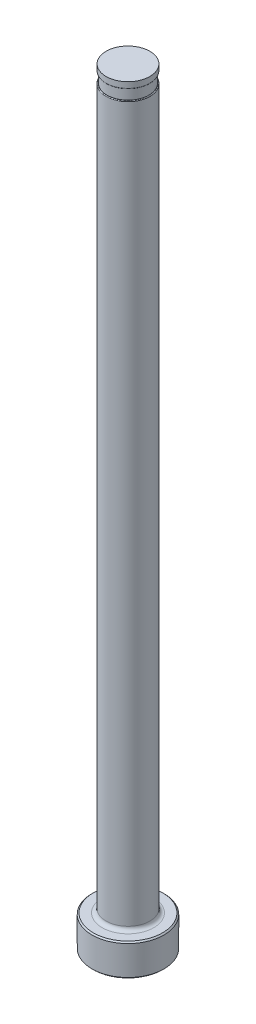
SolidWorks part; units mm, degrees
ref_plane "Front Plane" through (0, 0, 0) normal (0, 0, 1) x (1, 0, 0)
ref_plane "Top Plane" through (0, 0, 0) normal (0, 1, 0) x (1, 0, 0)
ref_plane "Right Plane" through (0, 0, 0) normal (1, 0, 0) x (0, 0, -1)
other "Configuration Table"
sketch "Sketch1" plane through (0, 0, 0) normal (0, 0, 1) x (1, 0, 0)
  line L0 (0, 259.9588) -> (0, -15.1925) construction
  line L1 (0, 0) -> (-7.1374, 0)
  line L2 (-7.1374, 0) -> (-7.1374, 6.35)
  line L3 (-7.1374, 6.35) -> (-4.365, 6.35)
  line L4 (-4.365, 6.35) -> (-4.365, 152.4)
  line L5 (-4.365, 152.4) -> (0, 152.4)
  line L6 (0, 152.4) -> (0, 0)
  dimension "L" = 152.4
  dimension "H" = 14.2748
  dimension "T" = 6.35
  dimension "D" = 8.73
revolve "Revolve1" add sketch "Sketch1" angle 360 about L0
chamfer "Chamfer1" distance 0.254 angle 45 2 edges at (0, 6.35, 7.1374) (0, 0, 7.1374)
fillet "Fillet1" radius 0.762 1 edges at (0, 6.35, 4.365)
sketch "Sketch2" plane through (0, 0, 0) normal (0, 0, 1) x (1, 0, 0)
  line L0 (-4.365, 152.4) -> (-4.365, 7.112) construction
  line L1 (-4.365, 151.13) -> (-4.1618, 151.13)
  line L2 (-4.365, 151.13) -> (-4.365, 149.098)
  line L3 (-4.365, 149.098) -> (-4.1618, 149.098)
  line L4 (-4.1618, 151.13) -> (-4.1618, 149.098)
  line L5 (4.365, 152.4) -> (-4.365, 152.4) construction
  line L6 (0, 153.4483) -> (0, 147.3282) construction
  dimension "D1" = 2.032
  dimension "N" = 1.27
  dimension "FD" = 0.2032
  dimension "D3" = 8.3236
revolve "Vent Relief" cut sketch "Sketch2" angle 360 about L6
sketch "Sketch3" plane through (0, 0, 0) normal (0, 0, 1) x (1, 0, 0)
  line L0 (-4.1618, 150.114) -> (-4.1618, 86.614)
  line L1 (-4.1618, 151.13) -> (-4.1618, 149.098) construction
  line L2 (-4.365, 149.098) -> (-4.365, 7.112) construction
  line L3 (-4.365, 85.4964) -> (-4.365, 150.114)
  line L4 (-4.365, 150.114) -> (-4.1618, 150.114)
  arc A0 (-4.1618, 86.614) -> (-4.365, 85.4964) centre (-7.3368, 86.614) cw
  dimension "D1" = 3.175
  dimension "D2" = 63.5
extrude "D-Slot" cut sketch "Sketch3" against normal through all both and the other way through all
sketch "Sketch5" plane through (0, 0, 0) normal (0, 0, 1) x (1, 0, 0)
  line L0 (-4.365, 151.13) -> (4.365, 151.13) construction
  line L1 (-4.365, 152.4) -> (-4.3459, 152.4)
  line L2 (-4.365, 152.4) -> (-4.365, 151.13)
  line L3 (-4.365, 151.13) -> (-4.3459, 151.13)
  line L4 (-4.3459, 152.4) -> (-4.3459, 151.13)
  line L5 (0, 152.6877) -> (0, 150.5771) construction
  dimension "VP" = 0.019
revolve "Vent Diameter" cut sketch "Sketch5" angle 360 about L5
fillet "Fillet2" radius 0.127 2 edges at (4.365, 149.098, 0) (0, 151.13, 4.3459)
sketch "Pocket Sketch" plane through (0, 0, 0) normal (0, 0, 1) x (1, 0, 0)
  line L0 (-7.5343, 0) -> (-7.5343, 6.3754)
  line L1 (-7.5343, 6.3754) -> (-5.3254, 6.3754)
  line L2 (-4.5634, 7.1374) -> (-4.5634, 22.225)
  line L3 (-4.5634, 22.225) -> (0, 22.225)
  line L4 (0, 22.225) -> (0, 0)
  line L5 (0, 0) -> (-7.5343, 0)
  line L6 (0, 12.6104) -> (0, -2.4989) construction
  line L7 (-7.1374, 6.096) -> (-7.1374, 0.254) construction
  line L8 (6.8834, 6.35) -> (-6.8834, 6.35) construction
  line L9 (-4.365, 85.4964) -> (-4.365, 7.112) construction
  line L10 (-5.3254, 6.3754) -> (-4.5634, 7.1374)
  point P3 (-4.5634, 6.3754)
  dimension "D1" = 15.0685
  dimension "D2" = 0.3969
  dimension "D3" = 0.0254
  dimension "D4" = 0.1984
  dimension "D5" = 9.1269
  dimension "D6" = 22.225
